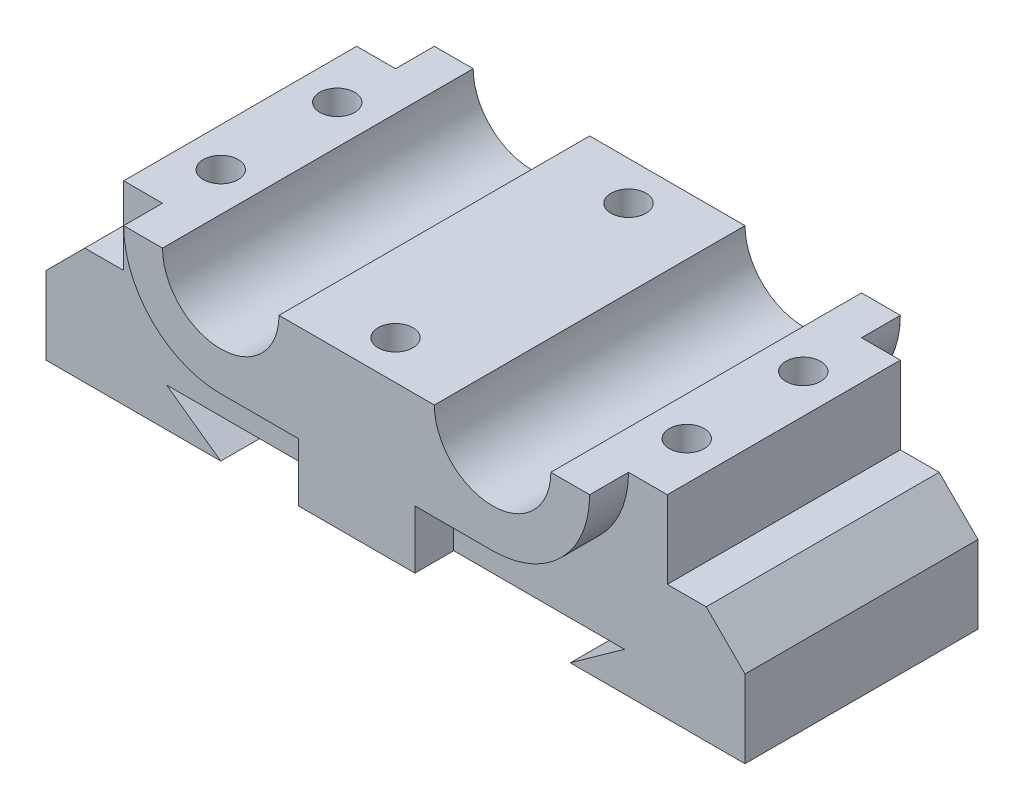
SolidWorks part; units mm, degrees
ref_plane "Front Plane" through (0, 0, 0) normal (0, 0, 1) x (1, 0, 0)
ref_plane "Top Plane" through (0, 0, 0) normal (0, 1, 0) x (1, 0, 0)
ref_plane "Right Plane" through (0, 0, 0) normal (1, 0, 0) x (0, 0, -1)
sketch "Sketch1" plane through (0, 0, 0) normal (0, 0, 1) x (1, 0, 0)
  line L0 (-45, 0) -> (-22.5, 0)
  line L1 (-22.5, 0) -> (-29.4718, 5)
  line L2 (-29.4718, 5) -> (-7.5, 5)
  line L4 (-35, 25) -> (-30, 25)
  line L5 (-45, 0) -> (-45, 15)
  line L6 (-45, 15) -> (-35, 15)
  line L7 (-35, 15) -> (-35, 25)
  line L8 (-17.5, 12.5) -> (7.5, 12.5)
  line L11 (45, 0) -> (22.5, 0)
  line L12 (22.5, 0) -> (29.4718, 5)
  line L13 (29.4718, 5) -> (-7.5, 5)
  line L15 (17.5, 12.5) -> (7.5, 12.5)
  line L16 (35, 25) -> (30, 25)
  line L17 (35, 15) -> (35, 25)
  line L18 (45, 15) -> (35, 15)
  line L19 (45, 0) -> (45, 15)
  arc A0 (-30, 25) -> (-17.5, 12.5) centre (-17.5, 25) ccw
  arc A2 (30, 25) -> (17.5, 12.5) centre (17.5, 25) cw
  point P6 (6.8023, 12.5)
  point P7 (-7.5, 5)
  point P12 (-7.5, 5)
  point P15 (-6.6501, 5)
  dimension "D10" = 25
  dimension "D1" = 22.5
  dimension "D2" = 22.5
  dimension "D3" = 5
  dimension "D4" = 7.5
  dimension "D5" = 15
  dimension "D6" = 35
  dimension "D7" = 10
  dimension "D8" = 35.647
  dimension "D9" = 17.5
  dimension "D11" = 25
extrude "Boss-Extrude1" add sketch "Sketch1" along normal mid plane 30 contours L2 L13 L12 L11 L19 L18 L17 L16 A2 L15 L8 A0 L4 L7 L6 L5 L0 L1
sketch "Sketch6" plane through (0, 0, 0) normal (0, 0, 1) x (1, 0, 0)
  line L2 (17.5, 12.5) -> (-17.5, 12.5) construction
  line L3 (30, 25) -> (25, 25)
  line L4 (-30, 25) -> (-25, 25)
  line L5 (-7.5, 12.5) -> (-17.5, 12.5)
  line L6 (-10, 25) -> (10, 25)
  line L7 (-17.5, 12.5) -> (-7.5, 12.5)
  line L8 (-7.5, 12.5) -> (-7.5, 5)
  line L9 (-29.4718, 5) -> (29.4718, 5) construction
  line L10 (0, 0) -> (0, 22.1732) construction
  line L11 (7.5, 12.5) -> (17.5, 12.5)
  line L12 (7.5, 12.5) -> (7.5, 5)
  line L13 (-7.5, 5) -> (7.5, 5)
  arc A0 (17.5, 12.5) -> (30, 25) centre (17.5, 25) ccw construction
  arc A1 (-30, 25) -> (-17.5, 12.5) centre (-17.5, 25) ccw construction
  arc A2 (17.5, 12.5) -> (30, 25) centre (17.5, 25) ccw
  arc A3 (-30, 25) -> (-17.5, 12.5) centre (-17.5, 25) ccw
  arc A4 (-25, 25) -> (-10, 25) centre (-17.5, 25) ccw
  arc A5 (10, 25) -> (25, 25) centre (17.5, 25) ccw
  dimension "D1" = 15
  dimension "D2" = 7.5
extrude "Boss-Extrude8" add sketch "Sketch6" along normal mid plane 40
chamfer "Chamfer2" distance 5 angle 45 2 edges at (-45, 15, 0) (45, 15, 0)
sketch "Sketch7" plane through (0, 25, 0) normal (0, 1, 0) x (1, 0, 0)
  line L0 (0, 0) -> (30.3987, 0) construction
  line L1 (0, 0) -> (0, -10.351) construction
  circle A0 centre (0, 15) radius 2.25
  circle A1 centre (-30, 7.5) radius 2.25
  circle A2 centre (-30, -7.5) radius 2.25
  circle A3 centre (0, -15) radius 2.25
  circle A4 centre (30, -7.5) radius 2.25
  circle A5 centre (30, 7.5) radius 2.25
  dimension "D1" = 4.5
  dimension "D2" = 4.5
  dimension "D3" = 7.5
  dimension "D4" = 30
  dimension "D5" = 15
extrude "Cut-Extrude2" cut sketch "Sketch7" against normal blind 15
